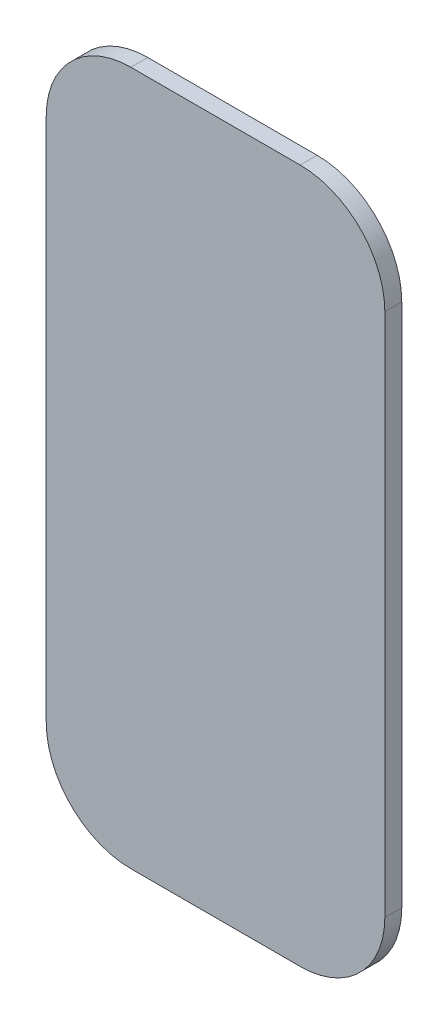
SolidWorks part; units mm, degrees
ref_plane "Front Plane" through (0, 0, 0) normal (0, 0, 1) x (1, 0, 0)
ref_plane "Top Plane" through (0, 0, 0) normal (0, 1, 0) x (1, 0, 0)
ref_plane "Right Plane" through (0, 0, 0) normal (1, 0, 0) x (0, 0, -1)
sketch "Sketch1" plane through (0, 0, 0) normal (0, 0, 1) x (1, 0, 0)
  line L1 (-250, 1025) -> (250, 1025)
  line L2 (-500, 775) -> (-500, -775)
  line L3 (-250, -1025) -> (250, -1025)
  line L4 (500, 775) -> (500, -775)
  line L5 (-500, 1025) -> (500, -1025) construction
  line L6 (-500, -1025) -> (500, 1025) construction
  arc A0 (250, -1025) -> (500, -775) centre (250, -775) ccw
  arc A1 (-500, -775) -> (-250, -1025) centre (-250, -775) ccw
  arc A2 (250, 1025) -> (500, 775) centre (250, 775) cw
  arc A3 (-250, 1025) -> (-500, 775) centre (-250, 775) ccw
  point P0 (0, 0)
  dimension "D3" = 250
  dimension "D1" = 1000
  dimension "D2" = 2050
extrude "Boss-Extrude1" add sketch "Sketch1" against normal blind 50
